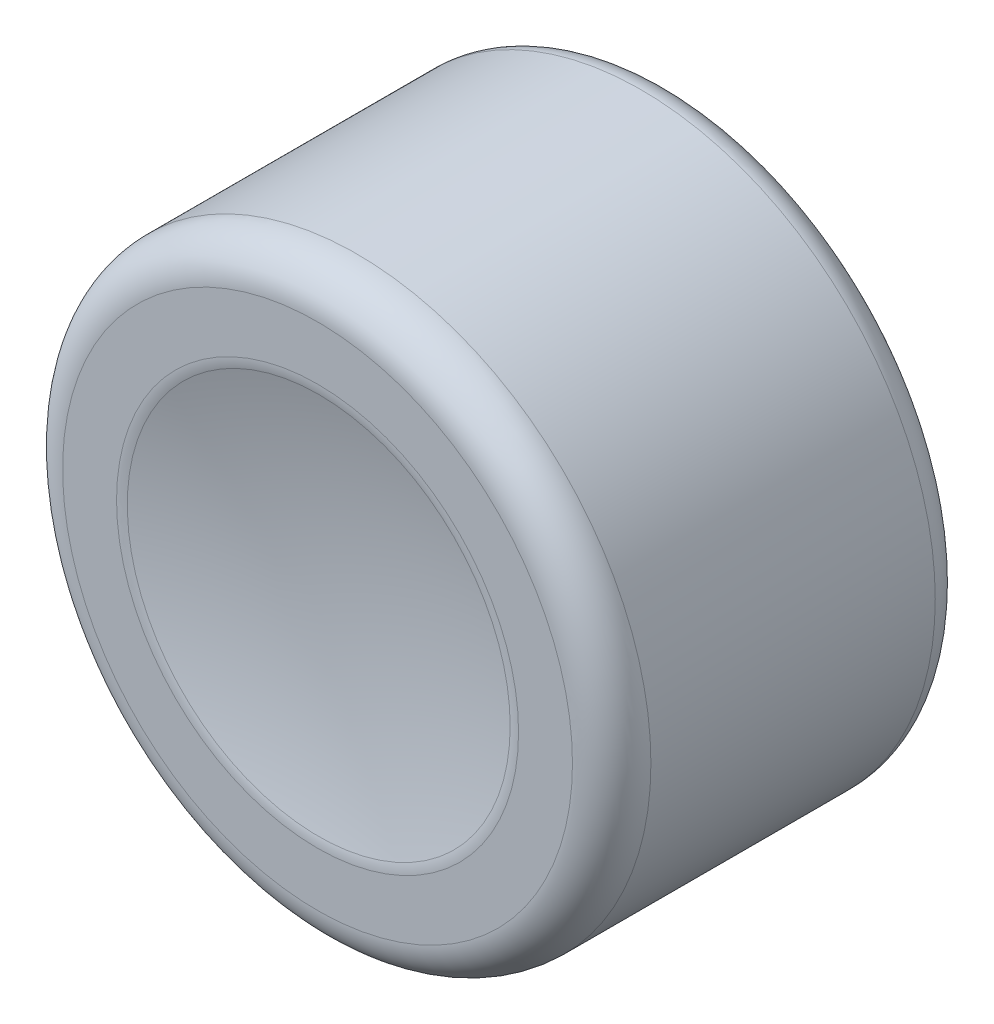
SolidWorks part; units mm, degrees
ref_plane "Plan1" through (0, 0, 0) normal (0, 0, 1) x (1, 0, 0)
ref_plane "Plan2" through (0, 0, 0) normal (0, 1, 0) x (1, 0, 0)
ref_plane "Plan3" through (0, 0, 0) normal (1, 0, 0) x (0, 0, -1)
sketch "Esquisse1" plane through (0, 0, 0) normal (0, 0, 1) x (1, 0, 0)
  circle A0 centre (0, 0) radius 15
  dimension "D1" = 30
extrude "Base-Extrusion" add sketch "Esquisse1" along normal blind 18
sketch "Esquisse2" plane through (0, 0, 0) normal (1, 0, 0) x (0, 0, -1)
  line L1 (-18, 15) -> (-18, -15) construction
  line L2 (0, 0) -> (-46.3876, 0) construction
  line L3 (-18, 0) -> (0, 0) construction
  line L4 (-18, 10) -> (-18, 0)
  line L5 (0, 15) -> (-18, 15) construction
  line L6 (-16.7298, 0) -> (-18, 0)
  arc A0 (-18, 10) -> (-16.7298, 0) centre (-56.7298, 0) cw
  dimension "D1" = 40
  dimension "D2" = 5
revolve "Enlèvement de matière-Révolution1" cut sketch "Esquisse2" angle 360 about L2
fillet "Congé1" radius 2
shell "Coque1" thickness 2.5
fillet "Congé2" radius 1.5
chamfer "Chanfrein1" distance 0.5 angle 45
fillet "Congé3" radius 1
